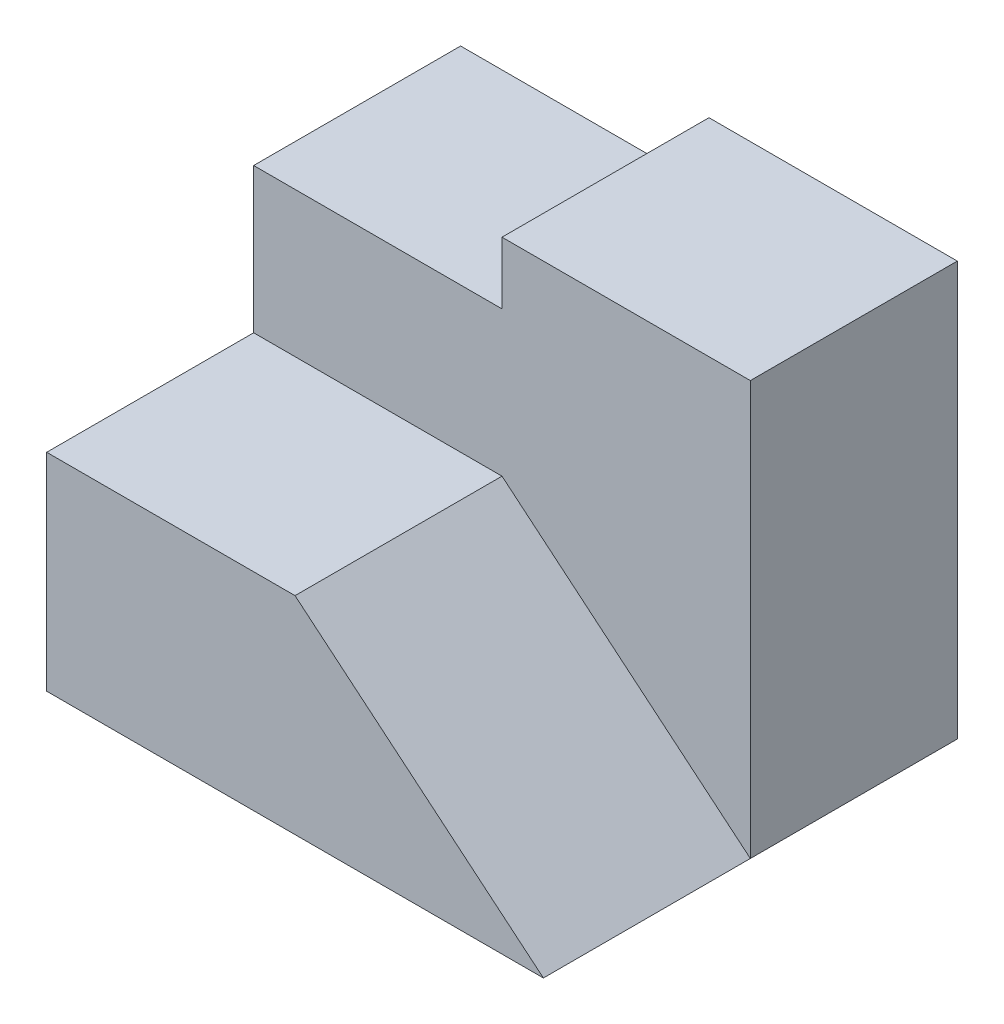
SolidWorks part; units mm, degrees
ref_plane "前视基准面" through (0, 0, 0) normal (0, 0, 1) x (1, 0, 0)
ref_plane "上视基准面" through (0, 0, 0) normal (0, 1, 0) x (1, 0, 0)
ref_plane "右视基准面" through (0, 0, 0) normal (1, 0, 0) x (0, 0, -1)
sketch "草图1" plane through (0, 0, 0) normal (0, 0, 1) x (1, 0, 0)
  line L0 (0, 0) -> (120, 0)
  line L1 (0, 0) -> (0, 50)
  line L2 (0, 50) -> (60, 50)
  line L3 (60, 50) -> (120, 0)
extrude "拉伸1" add sketch "草图1" against normal blind 50
sketch "草图2" plane through (0, 0, -50) normal (0, 0, -1) x (-1, 0, 0)
  line L0 (0, 0) -> (0, 85)
  line L1 (-120, 100) -> (-60, 100)
  line L2 (-60, 100) -> (-60, 85)
  line L3 (-60, 85) -> (0, 85)
  line L4 (-120, 100) -> (-120, 0)
  line L5 (0, 0) -> (-120, 0)
extrude "拉伸2" add sketch "草图2" along normal blind 50
